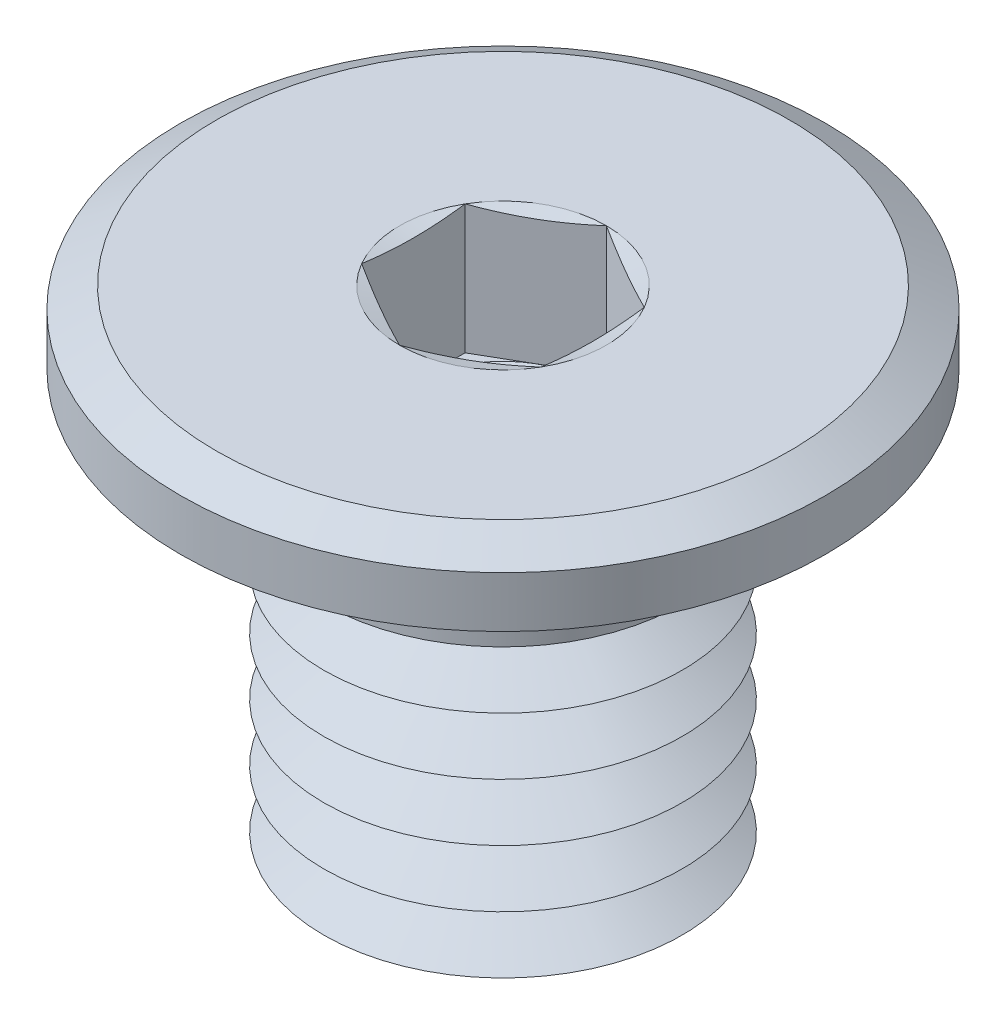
SolidWorks part; units mm, degrees
ref_plane "Front Plane" through (0, 0, 0) normal (0, 0, 1) x (1, 0, 0)
ref_plane "Top Plane" through (0, 0, 0) normal (0, 1, 0) x (1, 0, 0)
ref_plane "Right Plane" through (0, 0, 0) normal (1, 0, 0) x (0, 0, -1)
sketch "Sketch1" plane through (0, 0, 0) normal (0, 1, 0) x (1, 0, 0)
  circle A0 centre (0, 0) radius 4.5
  dimension "D1" = 9
extrude "Boss-Extrude1" add sketch "Sketch1" against normal blind 1
sketch "Sketch2" plane through (0, -1, 0) normal (0, -1, 0) x (1, 0, 0)
  circle A0 centre (0, 0) radius 2.5
  dimension "D1" = 5
extrude "Boss-Extrude2" add sketch "Sketch2" along normal blind 6
sketch "Sketch3" plane through (0, 0, 0) normal (1, 0, 0) x (0, 0, -1)
  line L0 (0, 0.9906) -> (0, -8.2999) construction
sketch "Sketch5" plane through (0, 0, 0) normal (1, 0, 0) x (0, 0, -1)
  line L0 (-2.5, -7.4) -> (-1.8072, -7)
  line L1 (-2.5, -1) -> (-2.5, -7) construction
  line L2 (-1.8072, -7) -> (-2.5, -6.6)
  line L3 (-2.5, -1) -> (-2.5, -7) construction
  line L4 (-2.5, -6.6) -> (-2.5, -7.4)
  line L6 (-2.5, -1) -> (-2.5, -7) construction
  line L7 (-2.5, -1) -> (-2.5, -7) construction
  line L14 (-2.5, -7) -> (2.5, -7) construction
  dimension "D1" = 0.8
revolve "Cut-Revolve1" cut sketch "Sketch5" angle 360 about L0
pattern_linear "LPattern1" count 6 spacing 0.8 along (0, 1, 0) of "Cut-Revolve1"
fillet "Fillet1" radius 0.2 1 edges at (0, -1, -2.5)
chamfer "Chamfer2" distance 0.5 angle 30 1 edges at (0, 0, 4.5)
sketch "Sketch6" plane through (0, 0, 0) normal (0, 1, 0) x (1, 0, 0)
  line L1 (0, 1.4434) -> (-1.25, 0.7217)
  line L2 (-1.25, 0.7217) -> (-1.25, -0.7217)
  line L3 (-1.25, -0.7217) -> (0, -1.4434)
  line L4 (0, -1.4434) -> (1.25, -0.7217)
  line L5 (1.25, -0.7217) -> (1.25, 0.7217)
  line L6 (1.25, 0.7217) -> (0, 1.4434)
  circle A0 centre (0, 0) radius 1.25 construction
  dimension "D1" = 2.5
extrude "Cut-Extrude1" cut sketch "Sketch6" against normal blind 1.8
sketch "Sketch7" plane through (0, -1.8, 0) normal (0, 1, 0) x (1, 0, 0)
  line L0 (-1.25, 0.7217) -> (-1.25, -0.7217) construction
  circle A0 centre (0, 0) radius 1.25
extrude "Cut-Extrude2" cut sketch "Sketch7" against normal through all draft 60
sketch "Sketch8" plane through (0, 0, 0) normal (0, 1, 0) x (1, 0, 0)
  circle A0 centre (0, 0) radius 1.4434
extrude "Cut-Extrude3" cut sketch "Sketch8" against normal through all draft 75
